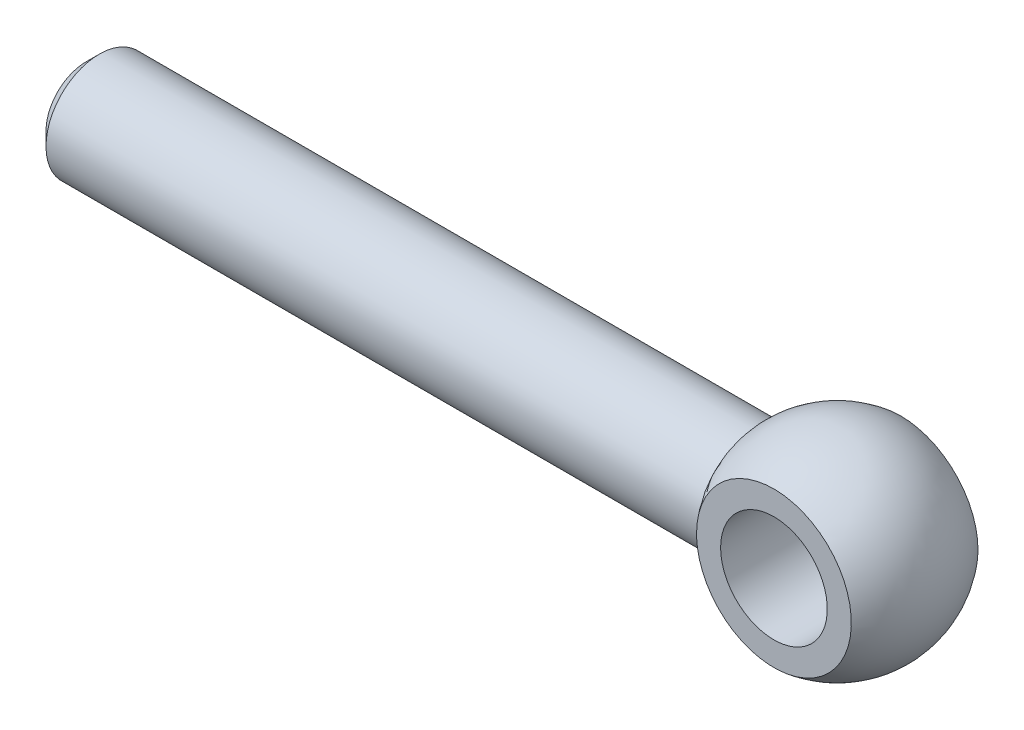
SolidWorks part; units mm, degrees
ref_plane "Plan de face" through (0, 0, 0) normal (0, 0, 1) x (1, 0, 0)
ref_plane "Plan de dessus" through (0, 0, 0) normal (0, 1, 0) x (1, 0, 0)
ref_plane "Plan de droite" through (0, 0, 0) normal (1, 0, 0) x (0, 0, -1)
imported_body "Importée3"
sketch "Esquisse1" plane through (-6.3443, 0, 0) normal (-1, 0, 0) x (0, 0, 1)
  circle A0 centre (0, 0) radius 4
extrude "Boss.-Extru.1" add sketch "Esquisse1" along normal blind 50
hole_wizard "Diamètre du perçage Ø8.0 (8)1" positions "Esquisse3" profile "Esquisse2" hole size "Ø8.0" standard "Ansi Metric"
sketch "Esquisse3" plane through (0, 0, -4.75) normal (0, 0, -1) x (-1, 0, 0)
  point P0 (0, 0)
sketch "Esquisse2" plane through (0, 0, -4.75) normal (1, 0, 0) x (0, 1, 0)
  line L0 (0, 0) -> (0, 12.25)
  line L1 (0, 12.25) -> (4, 12.25)
  line L2 (4, 12.25) -> (4, 0)
  line L5 (4, 0) -> (0, 0)
  line L11 (0, -6.35) -> (0, 107.95) construction
  dimension "Diamètre du perçage jusqu'au prochain" = 8
  dimension "Profondeur du perçage jusqu'au prochain" = 12.25
chamfer "Chanfrein1" distance 1 angle 45 1 edges at (-56.3443, 0, 4)
sketch "Esquisse4" plane through (0, 0, -4.75) normal (0, 0, -1) x (-1, 0, 0)
  circle A0 centre (0, 0) radius 7.5
  dimension "D1" = 15
